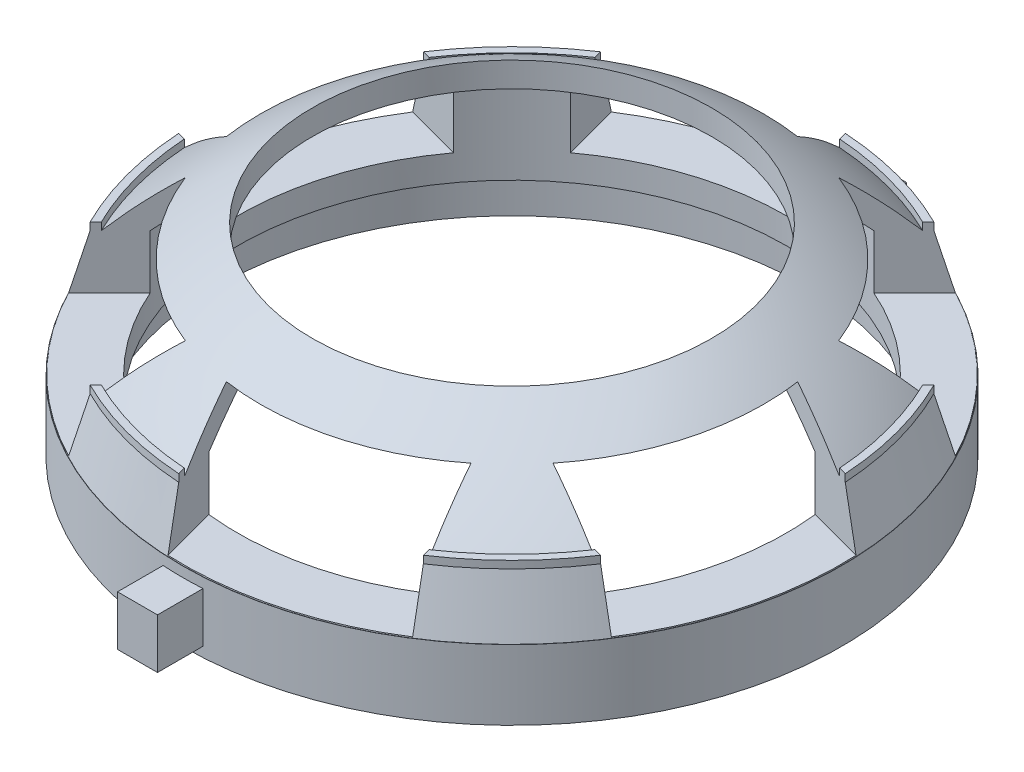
SolidWorks part; units mm, degrees
ref_plane "Front Plane" through (0, 0, 0) normal (0, 0, 1) x (1, 0, 0)
ref_plane "Top Plane" through (0, 0, 0) normal (0, 1, 0) x (1, 0, 0)
ref_plane "Right Plane" through (0, 0, 0) normal (1, 0, 0) x (0, 0, -1)
sketch "Sketch1" plane through (0, 0, 0) normal (0, 0, 1) x (1, 0, 0)
  line L0 (0, 0) -> (0, 2.0474) construction
  line L5 (5.9, 0) -> (6.6, 0)
  line L6 (5.9, 0) -> (5.9, 0.9)
  line L8 (6.6, 0) -> (6.6, 1.4)
  line L9 (5.9, 0.9) -> (5.5, 0.9)
  line L11 (6.15, 2.5) -> (5.5, 2.5) construction
  line L12 (5.5, 0.9) -> (5.5, 2.5)
  line L13 (4, 4.0441) -> (4, 3.5452)
  line L15 (6.5947, 1.3416) -> (6.5947, 1.4) construction
  line L16 (6.5947, 1.4) -> (6.6, 1.4)
  line L18 (4, 3.5452) -> (4, 2.2737) construction
  line L19 (4, 6.5703) -> (4, 4.0441) construction
  line L20 (0, 0) -> (7.9395, 0) construction
  line L21 (6.5947, 1.4) -> (6.3, 2.5)
  line L22 (6.3, 2.5) -> (6.15, 2.5) construction
  line L23 (6.15, 2.5) -> (6.5947, 1.3416) construction
  line L24 (6.15, 2.5) -> (6.15, 2.65)
  line L25 (6.15, 2.65) -> (6.3, 2.65)
  line L26 (6.3, 2.65) -> (6.3, 2.5)
  line L27 (0, 5.0058) -> (6.9836, 5.0058) construction
  arc A0 (6.15, 2.5) -> (4, 4.0441) centre (0, -3.7942) ccw
  arc A1 (6.6, 1.3348) -> (6.5488, 1.4) centre (0, -3.7942) ccw construction
  arc A2 (4, 4.0441) -> (6.15, 2.5) centre (0, -3.7942) ccw construction
  arc A3 (4, 3.5452) -> (6.6, 1.3348) centre (0, -3.7942) ccw construction
  arc A4 (6.5947, 1.3416) -> (5.5, 2.5) centre (0, -3.7942) ccw construction
  arc A5 (5.5, 2.5) -> (4, 3.5452) centre (0, -3.7942) ccw
  arc A6 (6.5488, 1.4) -> (6.5947, 1.3416) centre (0, -3.7942) ccw construction
  point P20 (6.5974, 1.4)
  dimension "D9" = 17.6
  dimension "D10" = 4
  dimension "D2" = 0.7
  dimension "D3" = 5.9
  dimension "D4" = 0.65
  dimension "D5" = 0.5
  dimension "D6" = 2.5
  dimension "D7" = 1.1
  dimension "D8" = 5.5
  dimension "D11" = 105
  dimension "D12" = 0.15
  dimension "D13" = 0.15
revolve "Revolve2" add sketch "Sketch1" angle 360 about L0
ref_plane "Plane1" through (0, 0, -7.5) normal (0, 0, 1) x (1, 0, 0)
sketch "Sketch2" plane through (0, 0, -7.5) normal (0, 0, 1) x (1, 0, 0)
  line L0 (6.6, 1.4) -> (-6.6, 1.4) construction
  line L1 (-0.4, 0.2) -> (0.4, 0.2)
  line L2 (-0.4, 0.2) -> (-0.4, 1.2)
  line L3 (-0.4, 1.2) -> (0.4, 1.2)
  line L4 (0.4, 0.2) -> (0.4, 1.2)
  point P6 (0, 1.2)
  dimension "D1" = 1
  dimension "D2" = 0.8
  dimension "D3" = 0.2
extrude "Boss-Extrude1" add sketch "Sketch2" along normal up to surface (0.9121 mm away)
ref_plane "Plane2" through (0, 0, 7.5) normal (0, 0, 1) x (1, 0, 0)
sketch "Sketch3" plane through (0, 0, 7.5) normal (0, 0, 1) x (1, 0, 0)
  line L0 (6.6, 1.4) -> (-6.6, 1.4) construction
  line L1 (-0.4, 0.2) -> (0.4, 0.2)
  line L2 (-0.4, 0.2) -> (-0.4, 1.2)
  line L3 (-0.4, 1.2) -> (0.4, 1.2)
  line L4 (0.4, 0.2) -> (0.4, 1.2)
  point P6 (0, 1.2)
  dimension "D1" = 0.8
  dimension "D2" = 1
  dimension "D3" = 0.2
extrude "Boss-Extrude2" add sketch "Sketch3" against normal blind 1
sketch "Sketch5" plane through (0, 0, 7.5) normal (0, 0, 1) x (1, 0, 0)
  line L1 (-2, 3.41) -> (2, 3.41)
  line L2 (-2, 3.41) -> (-2, 1.41)
  line L3 (-2, 1.41) -> (2, 1.41)
  line L4 (2, 3.41) -> (2, 1.41)
  dimension "D1" = 4
  dimension "D2" = 2
  dimension "D3" = 2
  dimension "D4" = 1.41
extrude "Cut-Extrude1" [suppressed] cut sketch "Sketch5" against normal blind 16
pattern_circular "CirPattern3" [suppressed] count 3 every 60 about axis through (0, 0, 0) along (0, 1, 0)
chamfer "Chamfer1" [suppressed] distance 0.3 angle 45
sketch "Sketch6" plane through (0, 0, 0) normal (0, 0, 1) x (1, 0, 0)
  line L0 (0, 0) -> (0, 5.5817) construction
ref_plane "Plane3" through (0, 0, 0) normal (0.7071, 0, -0.7071) x (0, 1, 0)
sketch "Sketch7" plane through (0, 0, 0) normal (0.7071, 0, -0.7071) x (0, 1, 0)
  line L0 (0, 5.9) -> (0, -5.9) construction
  line L1 (1.42, 2) -> (3.42, 2)
  line L2 (1.42, 2) -> (1.42, -2)
  line L3 (1.42, -2) -> (3.42, -2)
  line L4 (3.42, 2) -> (3.42, -2)
  dimension "D1" = 1.42
  dimension "D2" = 4
  dimension "D3" = 2
  dimension "D4" = 2
extrude "Cut-Extrude2" cut sketch "Sketch7" against normal blind 10
pattern_circular "CirPattern4" count 6 over 360 about axis through (0, 0, 0) along (0, 1, 0) of "Cut-Extrude2"
chamfer "Chamfer3" [suppressed] distance 0.7 angle 30
